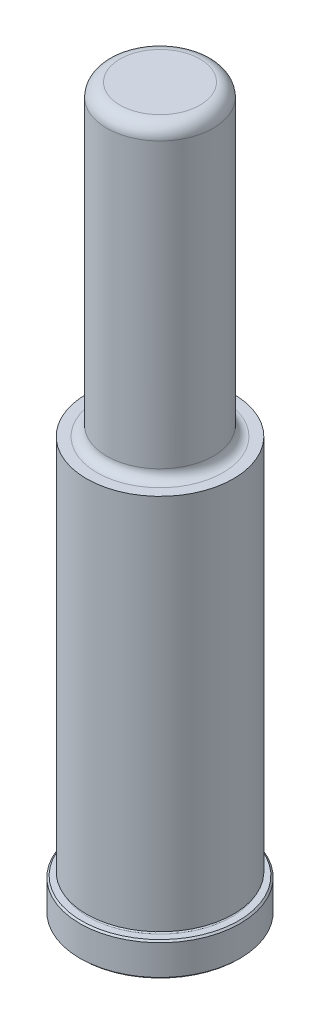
SolidWorks part; units mm, degrees
ref_plane "Front Plane" through (0, 0, 0) normal (0, 0, 1) x (1, 0, 0)
ref_plane "Top Plane" through (0, 0, 0) normal (0, 1, 0) x (1, 0, 0)
ref_plane "Right Plane" through (0, 0, 0) normal (1, 0, 0) x (0, 0, -1)
sketch "Sketch1" plane through (0, 0, 0) normal (1, 0, 0) x (0, 0, -1)
  line L0 (0, 0) -> (19.05, 0)
  line L1 (19.05, 0) -> (19.05, 7.9248)
  line L2 (19.05, 7.9248) -> (17.0688, 7.9248)
  line L3 (16.6878, 2.6782) -> (16.6878, 5.9795) construction
  line L4 (17.0688, 8.6868) -> (17.4752, 8.6868)
  line L5 (17.4752, 8.6868) -> (17.4752, 98.425)
  line L6 (17.4752, 98.425) -> (14.9733, 98.425)
  line L7 (12.6873, 100.711) -> (12.6873, 171.45)
  line L9 (12.6873, 171.45) -> (0, 171.45)
  line L10 (0, 171.45) -> (0, 0)
  line L11 (0, 0) -> (0, -7.2694) construction
  arc A0 (17.0688, 8.6868) -> (17.0688, 7.9248) centre (17.0688, 8.3058) ccw
  arc A1 (14.9733, 98.425) -> (12.6873, 100.711) centre (14.9733, 100.711) cw
  point P2 (12.6873, 171.45)
  point P14 (12.6873, 170.9488)
  point P19 (12.6873, 98.425)
  dimension "D14" = 0.762
  dimension "D8" = 2.286
  dimension "T" = 7.9248
  dimension "D2" = 0.762
  dimension "M" = 38.1
  dimension "B" = 34.9504
  dimension "L" = 171.45
  dimension "D7" = 0.7874
  dimension "A" = 98.425
  dimension "D" = 25.3746
  dimension "D15" = 73.025
revolve "Revolve1" add sketch "Sketch1" angle 360 about L11
chamfer "Chamfer1" distance 0.381 angle 45 2 edges at (0, 0, 19.05) (0, 7.9248, 19.05)
fillet "Fillet7" radius 3.175 1 edges at (0, 171.45, 12.6873)
